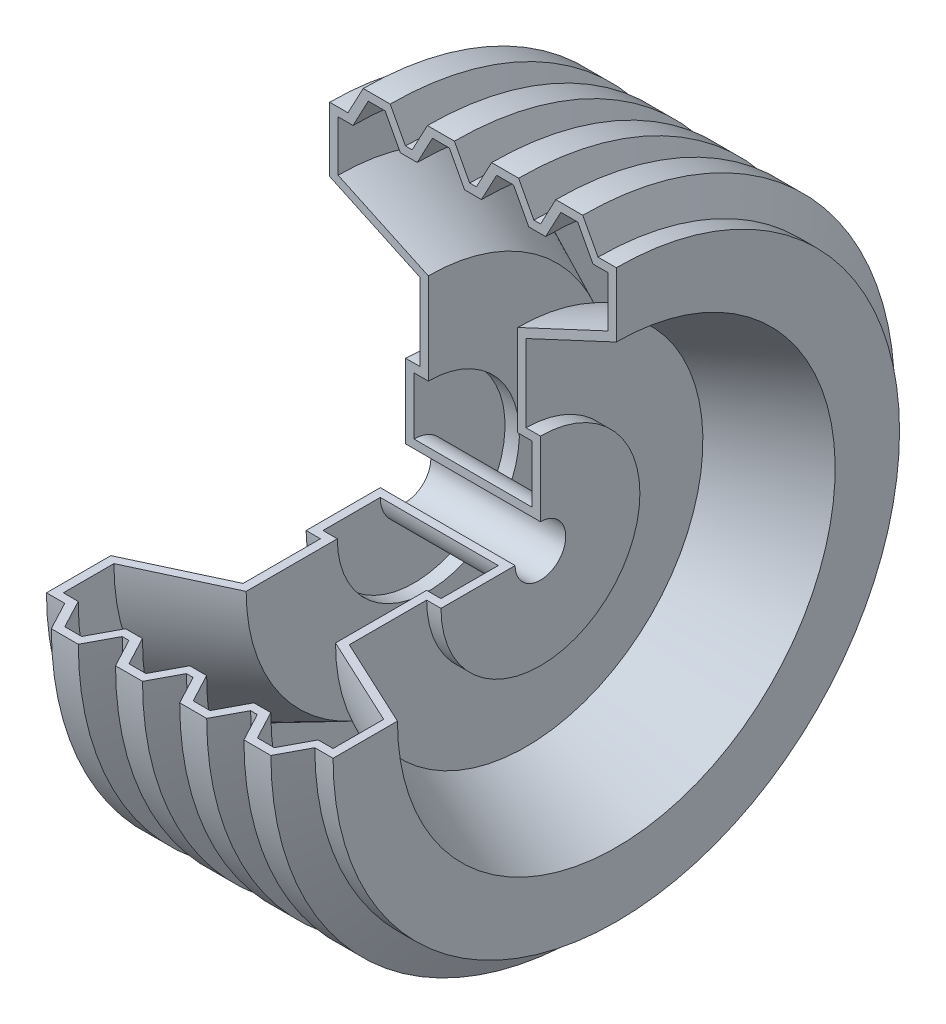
SolidWorks part; units mm, degrees
ref_plane "Front Plane" through (0, 0, 0) normal (0, 0, 1) x (1, 0, 0)
ref_plane "Top Plane" through (0, 0, 0) normal (0, 1, 0) x (1, 0, 0)
ref_plane "Right Plane" through (0, 0, 0) normal (1, 0, 0) x (0, 0, -1)
sketch "Sketch1" plane through (0, 0, 0) normal (0, 0, 1) x (1, 0, 0)
  line L0 (-56.6547, 0) -> (69.8986, 0) construction
  line L1 (0, 180) -> (0, -30.7186) construction
  line L2 (-35, 20) -> (35, 20)
  line L3 (35, 20) -> (35, 54)
  line L4 (-35, 20) -> (-35, 54)
  line L5 (35, 54) -> (26.5, 54)
  line L6 (-35, 54) -> (-26.5, 54)
  line L7 (26.5, 54) -> (26.5, 108.0525)
  line L8 (-26.5, 54) -> (-26.5, 108.0525)
  line L9 (26.5, 108.0525) -> (80, 133)
  line L10 (-26.5, 108.0525) -> (-80, 133)
  line L11 (80, 133) -> (80, 163)
  line L12 (-80, 133) -> (-80, 163)
  line L13 (80, 163) -> (71.1562, 163)
  line L14 (-80, 163) -> (-71.1562, 163)
  line L15 (71.1562, 163) -> (62.1172, 180)
  line L16 (-71.1562, 163) -> (-62.1172, 180)
  line L17 (62.1172, 180) -> (52.1172, 180)
  line L18 (-62.1172, 180) -> (-52.1172, 180)
  line L19 (52.1172, 180) -> (43.0781, 163)
  line L20 (-52.1172, 180) -> (-43.0781, 163)
  line L21 (43.0781, 163) -> (33.0781, 163)
  line L22 (-43.0781, 163) -> (-33.0781, 163)
  line L23 (33.0781, 163) -> (24.0391, 180)
  line L24 (-33.0781, 163) -> (-24.0391, 180)
  line L25 (24.0391, 180) -> (14.0391, 180)
  line L26 (-24.0391, 180) -> (-14.0391, 180)
  line L27 (14.0391, 180) -> (5, 163)
  line L28 (-14.0391, 180) -> (-5, 163)
  line L29 (5, 163) -> (-5, 163)
  point P8 (0, 20)
  point P34 (0, 163)
  dimension "D1" = 40
  dimension "D2" = 108
  dimension "D3" = 360
  dimension "D4" = 30
  dimension "D5" = 70
  dimension "D6" = 53
  dimension "D7" = 17
  dimension "D8" = 10
  dimension "D9" = 62
  dimension "D10" = 160
  dimension "D11" = 65
revolve "Revolve-Thin1" add sketch "Sketch1" angle 270 about L0
